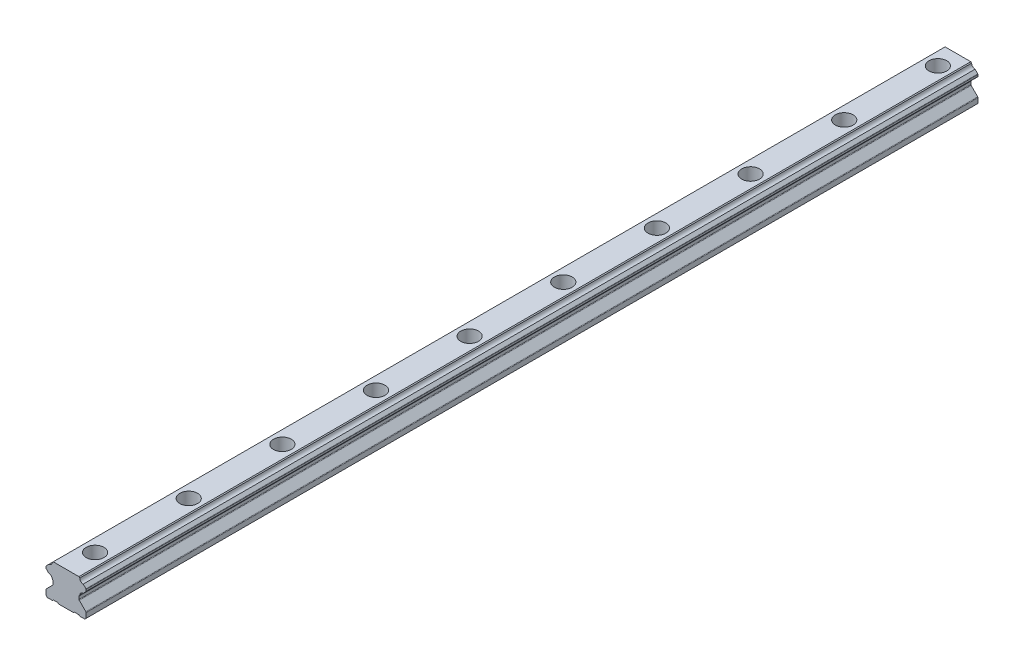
SolidWorks part; units mm, degrees
ref_plane "Front Plane" through (0, 0, 0) normal (0, 0, 1) x (1, 0, 0)
ref_plane "Top Plane" through (0, 0, 0) normal (0, 1, 0) x (1, 0, 0)
ref_plane "Right Plane" through (0, 0, 0) normal (1, 0, 0) x (0, 0, -1)
sketch "Sketch2" plane through (0, 0, 0) normal (0, 0, 1) x (1, 0, 0)
  line L0 (19.4993, 5.3467) -> (22.5302, 8.3777)
  line L1 (22.7645, 8.9434) -> (22.7645, 10.6813)
  line L2 (22.5302, 11.247) -> (19.4982, 14.279)
  line L3 (15.598, 18.1792) -> (14.6649, 19.1124)
  line L4 (14.6649, 19.1124) -> (-14.1358, 19.1124)
  line L5 (-14.1358, 19.1124) -> (-15.069, 18.1792)
  line L6 (-18.9692, 14.279) -> (-22.0012, 11.247)
  line L7 (-22.2355, 10.6813) -> (-22.2355, 8.9434)
  line L8 (-22.0012, 8.3777) -> (-18.9702, 5.3467)
  line L9 (-15.069, 1.4455) -> (-14.5869, 0.9635)
  line L10 (-14.2355, 0.1149) -> (-14.2355, -2.8903)
  line L11 (-14.5869, -3.7388) -> (-21.884, -11.0358)
  line L12 (-22.2355, -11.8844) -> (-22.2355, -17.3876)
  line L13 (-22.2355, -17.3876) -> (-20.7355, -18.8876)
  line L14 (-20.7355, -18.8876) -> (-14.9858, -18.8876)
  line L15 (-14.9858, -18.8876) -> (-13.9858, -17.8876)
  line L16 (-13.9858, -17.8876) -> (-8.9858, -17.8876)
  line L17 (-8.9858, -17.8876) -> (-7.9858, -18.8876)
  line L18 (-7.9858, -18.8876) -> (8.5142, -18.8876)
  line L19 (8.5142, -18.8876) -> (9.5142, -17.8876)
  line L20 (9.5142, -17.8876) -> (14.5142, -17.8876)
  line L21 (14.5142, -17.8876) -> (15.5142, -18.8876)
  line L22 (15.5142, -18.8876) -> (21.2645, -18.8876)
  line L23 (21.2645, -18.8876) -> (22.7645, -17.3876)
  line L24 (22.7645, -17.3876) -> (22.7645, -11.8844)
  line L25 (22.4131, -11.0358) -> (15.116, -3.7388)
  line L26 (14.7645, -2.8903) -> (14.7645, 0.1149)
  line L27 (15.116, 0.9635) -> (15.598, 1.4455)
  arc A0 (22.5302, 8.3777) -> (22.7645, 8.9434) centre (21.9645, 8.9434) ccw
  arc A1 (22.7645, 10.6813) -> (22.5302, 11.247) centre (21.9645, 10.6813) ccw
  arc A2 (15.598, 18.1792) -> (19.4982, 14.279) centre (19.5968, 18.2778) ccw
  arc A3 (-18.9692, 14.279) -> (-15.069, 18.1792) centre (-19.0678, 18.2778) ccw
  arc A4 (-22.0012, 11.247) -> (-22.2355, 10.6813) centre (-21.4355, 10.6813) ccw
  arc A5 (-22.2355, 8.9434) -> (-22.0012, 8.3777) centre (-21.4355, 8.9434) ccw
  arc A6 (-15.069, 1.4455) -> (-18.9702, 5.3467) centre (-19.0678, 1.3479) ccw
  arc A7 (-14.2355, 0.1149) -> (-14.5869, 0.9635) centre (-15.4355, 0.1149) ccw
  arc A8 (-14.5869, -3.7388) -> (-14.2355, -2.8903) centre (-15.4355, -2.8903) ccw
  arc A9 (-21.884, -11.0358) -> (-22.2355, -11.8844) centre (-21.0355, -11.8844) ccw
  arc A10 (22.7645, -11.8844) -> (22.4131, -11.0358) centre (21.5645, -11.8844) ccw
  arc A11 (14.7645, -2.8903) -> (15.116, -3.7388) centre (15.9645, -2.8903) ccw
  arc A12 (15.116, 0.9635) -> (14.7645, 0.1149) centre (15.9645, 0.1149) ccw
  arc A13 (19.4993, 5.3467) -> (15.598, 1.4455) centre (19.5968, 1.3479) ccw
extrude "Boss-Extrude1" add sketch "Sketch2" along normal blind 1000
sketch "Sketch3" plane through (0, 19.1124, 0) normal (0, 1, 0) x (1, 0, 0)
  line L0 (22.7645, -1000) -> (22.7645, 0) construction
  line L2 (14.6649, 0) -> (-14.1358, 0) construction
  point P0 (0.2645, -22.5)
  dimension "D1" = 22.5
  dimension "D2" = 22.5
hole_wizard "CBORE for M16 Hex Head Bolt1" positions "Sketch3" profile "Sketch4" counterbore size "M16" standard "DIN"
sketch "Sketch4" plane through (0.2645, 19.1124, 22.5) normal (1, 0, 0) x (0, 0, 1)
  line L0 (0, 0) -> (0, 38)
  line L1 (0, 38) -> (7, 38)
  line L3 (7, 38) -> (7, 17)
  line L4 (7, 17) -> (10, 17)
  line L5 (10, 17) -> (10, 0)
  line L7 (10, 0) -> (0, 0)
  line L11 (0, -6.35) -> (0, 107.95) construction
  dimension "Thru Hole Dia." = 14
  dimension "Thru Hole Depth" = 38
  dimension "C'Bore Dia." = 20
  dimension "C'Bore Depth" = 17
other "Fill Pattern1" parameters "D5"=0, "D6"=0, "D1"=105, "D2"=60, "D3"=0, "D9"=10, "D7"=10, "D8"=2
